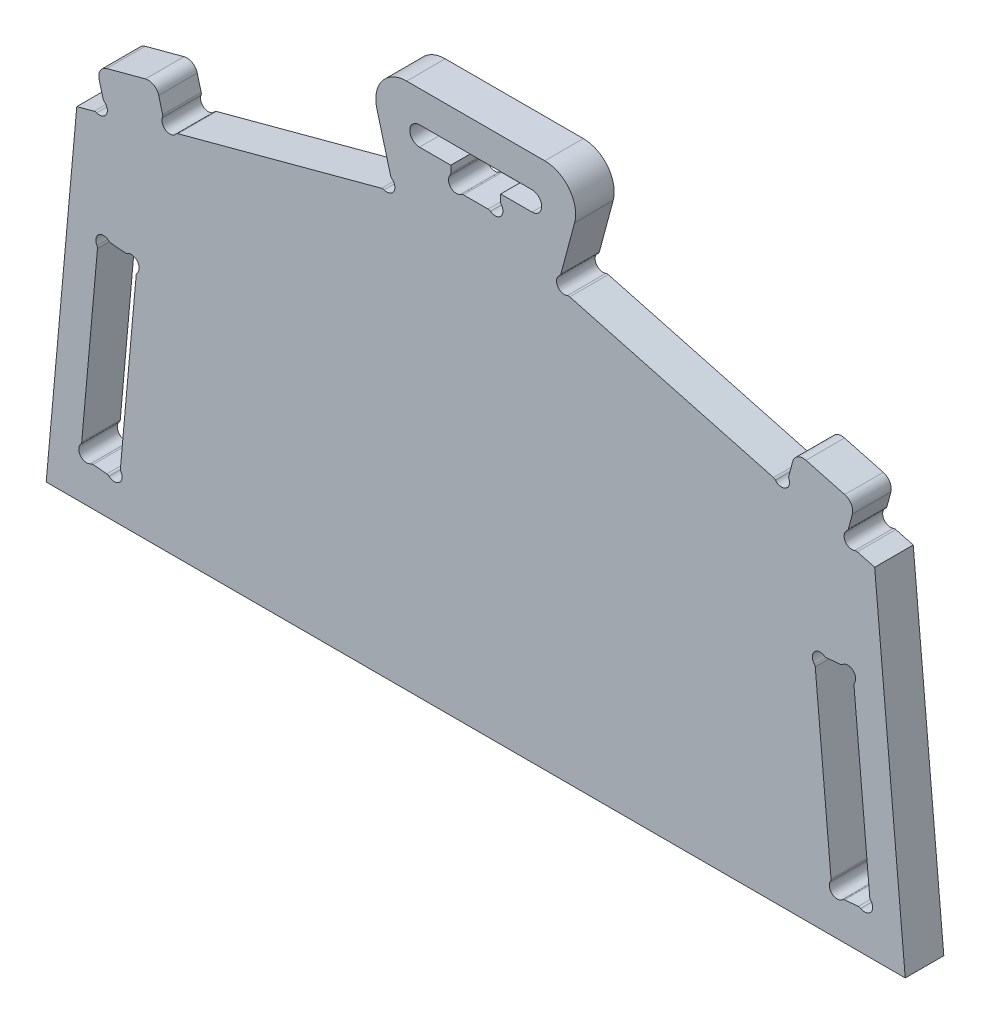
SolidWorks part; units mm, degrees
ref_plane "Front Plane" through (0, 0, 0) normal (0, 0, 1) x (1, 0, 0)
ref_plane "Top Plane" through (0, 0, 0) normal (0, 1, 0) x (1, 0, 0)
ref_plane "Right Plane" through (0, 0, 0) normal (1, 0, 0) x (0, 0, -1)
sketch "Sketch1" plane through (0, 0, 0) normal (0, 0, 1) x (1, 0, 0)
  line L0 (0, 0) -> (19.8314, 220.723)
  line L2 (278.5, 0) -> (0, 0)
  line L3 (71.1391, 260.3528) -> (32.5021, 250)
  line L4 (0, 0) -> (0, 250) construction
  line L5 (0, 250) -> (278.5, 250) construction
  line L6 (223.2918, 283.6579) -> (214.4051, 316.8236)
  line L7 (233.7236, 342) -> (278.5, 342)
  line L8 (278.5, 342) -> (278.5, 321.6254)
  line L9 (32.5021, 250) -> (36.8681, 233.7058)
  line L11 (71.1391, 260.3528) -> (75.5051, 244.0586)
  line L12 (85.4636, 238.3091) -> (217.5423, 273.6995)
  line L13 (77.6096, 236.2046) -> (82.7096, 245.0381) construction
  line L14 (151.5029, 256.0043) -> (145.0325, 280.1524) construction
  line L15 (278.5, 321.6254) -> (242.0017, 321.6254)
  line L16 (242.0017, 321.6254) -> (242.0017, 309.0754) construction
  line L17 (242.0017, 309.0754) -> (262.3247, 309.0754)
  line L18 (262.3247, 309.0754) -> (262.3247, 304.6565)
  line L19 (270.4558, 296.5254) -> (278.5, 296.5254)
  line L20 (278.5, 296.5254) -> (278.5, 0)
  line L21 (262.3247, 296.5254) -> (265.931, 300.1317) construction
  line L22 (19.8314, 220.723) -> (31.1186, 223.7474)
  line L23 (38.9726, 225.8519) -> (34.5558, 228.4019) construction
  line L24 (0, 0) -> (0, 556.5) construction
  line L26 (0, 556.5) -> (50, 556.5) construction
  line L27 (50, 556.5) -> (0, 0) construction
  line L28 (235.9405, 313.7264) -> (238.7875, 303.1012) construction
  line L32 (0, 0) -> (557, 0) construction
  line L36 (-10.9646, 238.3531) -> (252.9747, 309.0754) construction
  line L37 (252.9747, 309.0754) -> (259.4451, 284.9273) construction
  line L38 (262.8784, 291.819) -> (258.2546, 309.0754) construction
  arc A0 (75.4157, 242.4937) -> (84.1531, 237.4492) centre (80.1596, 240.6213) ccw
  arc A1 (84.1531, 237.4492) -> (85.4636, 238.3091) centre (86.1106, 235.8943) cw
  arc A2 (75.4157, 242.4937) -> (75.5051, 244.0586) centre (73.0903, 243.4116) ccw
  arc A3 (219.1072, 273.6101) -> (217.5423, 273.6995) centre (218.1893, 271.2846) ccw
  arc A4 (224.1516, 282.3474) -> (219.1072, 273.6101) centre (220.9795, 278.3539) cw
  arc A5 (224.1516, 282.3474) -> (223.2918, 283.6579) centre (225.7066, 284.305) cw
  arc A6 (214.4051, 316.8236) -> (233.7236, 342) centre (233.7236, 322) cw
  arc A7 (32.6835, 223.658) -> (37.728, 232.3953) centre (34.5558, 228.4019) ccw
  arc A8 (242.0017, 321.6254) -> (242.0017, 309.0754) centre (242.0017, 315.3504) ccw
  arc A9 (261.8333, 303.1681) -> (268.9673, 296.0341) centre (265.931, 300.1317) ccw
  arc A10 (268.9673, 296.0341) -> (270.4558, 296.5254) centre (270.4558, 294.0254) cw
  arc A11 (261.8333, 303.1681) -> (262.3247, 304.6565) centre (259.8247, 304.6565) ccw
  arc A12 (32.6835, 223.658) -> (31.1186, 223.7474) centre (31.7656, 221.3326) ccw
  arc A13 (37.728, 232.3953) -> (36.8681, 233.7058) centre (39.2829, 234.3529) cw
  point P40 (278.5, 0)
extrude "Boss-Extrude1" add sketch "Sketch1" along normal blind 25 contours L0 L22 A12 A7 A13 L9 L3 L11 A2 A0 A1 L12 A3 A4 A5 L6 A6 L7 L8 L15 A8 L17 L18 A11 A9 A10 L19 L20 L2
sketch "Sketch2" plane through (0, 0, 0) normal (0, 0, 1) x (1, 0, 0)
  line L0 (32.6309, 0) -> (34.8434, 24.6253) construction
  line L1 (278.5, 0) -> (0, 0) construction
  line L3 (278.5, 0) -> (0, 0) construction
  line L4 (58.3522, 145.4754) -> (48.1205, 31.5962)
  line L5 (28.1375, 90.7909) -> (53.2364, 88.5358) construction
  line L6 (33.2533, 147.7305) -> (23.0216, 33.8513)
  line L7 (30.3924, 25.0252) -> (39.2945, 24.2254)
  line L8 (42.0794, 155.1013) -> (50.9814, 154.3014)
  line L9 (22.294, 25.7528) -> (35.971, 37.1748) construction
  line L10 (34.0806, 155.8199) -> (40.4073, 226.2363) construction
  line L11 (0, 0) -> (19.8314, 220.723) construction
  line L12 (0, 0) -> (19.8314, 220.723) construction
  line L13 (85.4636, 238.3091) -> (217.5423, 273.6995) construction
  line L14 (33.972, 155.7293) -> (59.0709, 153.4742) construction
  line L15 (34.0806, 155.8199) -> (22.3936, 25.7439) construction
  line L16 (0, 0) -> (19.8314, 220.723) construction
  arc A0 (22.399, 32.4128) -> (28.866, 24.669) centre (26.2085, 29.0219) ccw
  arc A1 (22.399, 32.4128) -> (23.0216, 33.8513) centre (20.5316, 34.075) ccw
  arc A2 (28.866, 24.669) -> (30.3924, 25.0252) centre (30.1687, 22.5353) cw
  arc A3 (40.7329, 23.6028) -> (39.2945, 24.2254) centre (39.0707, 21.7354) ccw
  arc A5 (48.4767, 30.0698) -> (40.7329, 23.6028) centre (44.1238, 27.4123) cw
  arc A7 (48.4767, 30.0698) -> (48.1205, 31.5962) centre (50.6105, 31.3725) cw
  arc A8 (58.9748, 146.9139) -> (58.3522, 145.4754) centre (60.8422, 145.2517) ccw
  arc A9 (58.9748, 146.9139) -> (52.5079, 154.6576) centre (55.1654, 150.3047) ccw
  arc A10 (52.5079, 154.6576) -> (50.9814, 154.3014) centre (51.2052, 156.7914) cw
  arc A11 (40.6409, 155.7238) -> (42.0794, 155.1013) centre (42.3031, 157.5912) ccw
  arc A12 (32.8971, 149.2569) -> (40.6409, 155.7238) centre (37.25, 151.9144) cw
  arc A13 (32.8971, 149.2569) -> (33.2533, 147.7305) centre (30.7634, 147.9542) cw
  point P21 (34.8434, 24.6253)
extrude "Cut-Extrude1" cut sketch "Sketch2" along normal through all
fillet "Fillet1" radius 7 2 edges at (71.1391, 260.3528, 12.5) (32.5021, 250, 12.5)
mirror "Symétrie1" about plane through (278.5, 296.5254, 25) normal (1, 0, 0)
ref_plane "Plane1" through (278.5, 0, 0) normal (1, 0, 0) x (0, 0, -1)
equation "\"tool_diameter\"=10"
equation "\"hole_clearance\"=0.1"
equation "\"material_thickness\"=25"
equation "\"clearance\"=0.1"
equation "\"outer_slot\"=0.5"
equation "\"fillet\"=7"
equation "\"D1@Boss-Extrude1\"=\"material_thickness\""
equation "\"D7@Sketch2\"=\"tool_diameter\"/2+\"hole_clearance\""
equation "\"D4@Sketch2\"=\"material_thickness\"/10"
equation "\"D6@Sketch2\"=\"material_thickness\"/2+\"clearance\""
equation "\"string\"= 2 * \"tool_diameter\" / 2 * cos ( 45deg )"
equation "\"angle\"= IIF ( \"string\" < \"limit\" , 45 , ( 180 - 2 * arcsin ( \"ThicknessVStool_dia\" ) ) / 2 )"
equation "\"limit\"= \"material_thickness\" / 2 * 5 / 6"
equation "\"ThicknessVStool_dia\"= IIF ( \"limit\" / \"tool_diameter\" > 1 , 1 , \"limit\" / \"tool_diameter\" )"
equation "\"D3@Sketch2\"=\"angle\""
equation "\"D4@Sketch1\"= \"tool_diameter\" / 2 + \"hole_clearance\""
equation "\"D5@Sketch1\"=\"material_thickness\"/10"
equation "\"D15@Sketch1\"=\"material_thickness\""
equation "\"D16@Sketch1\"=\"material_thickness\" + \"clearance\""
equation "\"D20@Sketch1\"=\"tool_diameter\"/2 +\"hole_clearance\""
equation "\"D19@Sketch1\"=\"material_thickness\"/10"
equation "\"D21@Sketch1\"=\"D16@Sketch1\"/2"
equation "\"D1@Fillet1\"=\"fillet\""
equation "\"D5@Sketch2\"=40 +\"material_thickness\" + \"clearance\"*2"
equation "\"D8@Sketch2\"=\"clearance\""
equation "\"D24@Sketch1\"=\"clearance\"+5"
equation "\"D25@Sketch1\"=(1220 - 2*13 - \"tool_diameter\"*2 - 50)/2  - \"tool_diameter\"/2"
equation "\"D17@Sketch1\"=(2440 - 8*13 - \"tool_diameter\"*11)/4"
equation "\"D26@Sketch1\"=\"D17@Sketch1\"/2 -\"tool_diameter\"/2"
equation "\"D9@Sketch2\"=\"clearance\""
